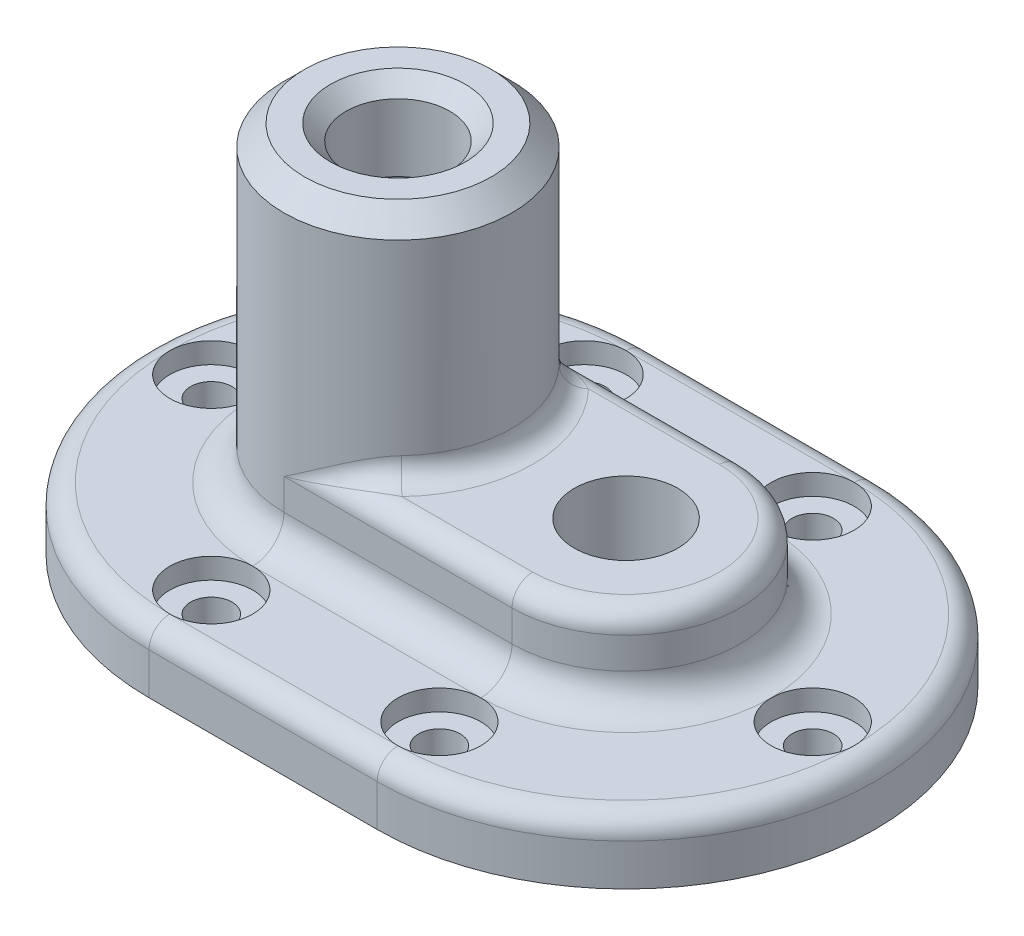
SolidWorks part; units mm, degrees
ref_plane "前视基准面" through (0, 0, 0) normal (0, 0, 1) x (1, 0, 0)
ref_plane "上视基准面" through (0, 0, 0) normal (0, 1, 0) x (1, 0, 0)
ref_plane "右视基准面" through (0, 0, 0) normal (1, 0, 0) x (0, 0, -1)
sketch "草图1" plane through (0, 0, 0) normal (0, 1, 0) x (1, 0, 0)
  line L0 (-63.9317, 0) -> (71.9633, 0) construction
  line L1 (0, 83.6894) -> (0, -87.8659) construction
  line L2 (44, 53.8118) -> (44, -61.2009) construction
  line L3 (0, 48) -> (44, 48)
  line L4 (0, -48) -> (44, -48)
  arc A0 (0, 48) -> (0, -48) centre (0, 0) ccw
  arc A1 (44, -48) -> (44, 48) centre (44, 0) ccw
  dimension "D2" = 48
  dimension "D3" = 48
  dimension "D1" = 44
extrude "凸台-拉伸1" add sketch "草图1" along normal blind 12
sketch "草图2" plane through (0, 12, 0) normal (0, 1, 0) x (1, 0, 0)
  line L0 (0, 22) -> (44, 22)
  line L1 (0, -22) -> (44, -22)
  arc A0 (0, 22) -> (0, -22) centre (0, 0) ccw
  arc A1 (44, -22) -> (44, 22) centre (44, 0) ccw
  dimension "D1" = 44
  dimension "D2" = 44
extrude "凸台-拉伸2" add sketch "草图2" along normal blind 16
sketch "草图3" plane through (0, 28, 0) normal (0, 1, 0) x (1, 0, 0)
  circle A0 centre (0, 0) radius 22
  dimension "D1" = 44
extrude "凸台-拉伸3" add sketch "草图3" along normal blind 44
sketch "草图4" plane through (0, 0, 0) normal (0, 0, 1) x (1, 0, 0)
  line L0 (0, 84.0249) -> (0, -16.1445) construction
  line L1 (-10, 72) -> (-10, 56)
  line L2 (22, 72) -> (-22, 72) construction
  line L3 (-10, 56) -> (-14.1139, 56)
  line L4 (-14.1139, 56) -> (-14.1139, 48)
  line L5 (-14.1139, 48) -> (-10, 48)
  line L6 (-10, 48) -> (-10, 0)
  line L7 (-48, 0) -> (0, 0) construction
  line L8 (-10, 0) -> (0, 0)
  line L9 (-10, 72) -> (0, 72)
  line L10 (0, 72) -> (0, 0)
  dimension "D1" = 10
  dimension "D2" = 10
  dimension "D3" = 56
  dimension "D4" = 8
revolve "切除-旋转1" cut sketch "草图4" angle 360 about L0
sketch "草图5" plane through (0, 0, 0) normal (0, 1, 0) x (1, 0, 0)
  circle A0 centre (44, 0) radius 10
  dimension "D1" = 20
extrude "切除-拉伸1" cut sketch "草图5" along normal blind 53
chamfer "倒角1" distance 4 angle 45 1 edges at (0, 72, 22)
chamfer "倒角2" distance 3 angle 45 1 edges at (-10, 72, 0)
chamfer "倒角3" distance 3 angle 45 1 edges at (-10, 0, 0)
chamfer "倒角4" distance 3 angle 45 1 edges at (44, 0, 10)
sketch "草图13" plane through (0, 0, 0) normal (0, 1, 0) x (1, 0, 0)
  circle A0 centre (0, 0) radius 36 construction
  circle A1 centre (44, 0) radius 36 construction
  circle A2 centre (0, 36) radius 4
  circle A3 centre (-36, 0) radius 4
  circle A4 centre (0, -36) radius 4
  circle A5 centre (80, 0) radius 4
  circle A6 centre (44, 36) radius 4
  circle A7 centre (44, -36) radius 4
  dimension "D1" = 72
  dimension "D2" = 72
  dimension "D3" = 8
extrude "切除-拉伸2" cut sketch "草图13" along normal through all
sketch "草图14" plane through (0, 12, 0) normal (0, 1, 0) x (1, 0, 0)
  circle A0 centre (-36, 0) radius 8
  circle A1 centre (0, 36) radius 8
  circle A2 centre (44, 36) radius 8
  circle A3 centre (80, 0) radius 8
  circle A4 centre (44, -36) radius 8
  circle A5 centre (0, -36) radius 8
  dimension "D1" = 16
extrude "切除-拉伸3" cut sketch "草图14" against normal blind 4
fillet "圆角1" radius 4 4 edges at (22, 12, -48) (-48, 12, 0) (22, 12, 48) (92, 12, 0)
fillet "圆角2" radius 6 4 edges at (22, 12, -22) (66, 12, 0) (22, 12, 22) (-22, 12, 0)
fillet "圆角4" radius 4 3 edges at (66, 28, 0)
fillet "圆角5" radius 4 3 edges at (9.1656, 27.4642, 19.9998) (9.1656, 27.4642, -19.9998)
